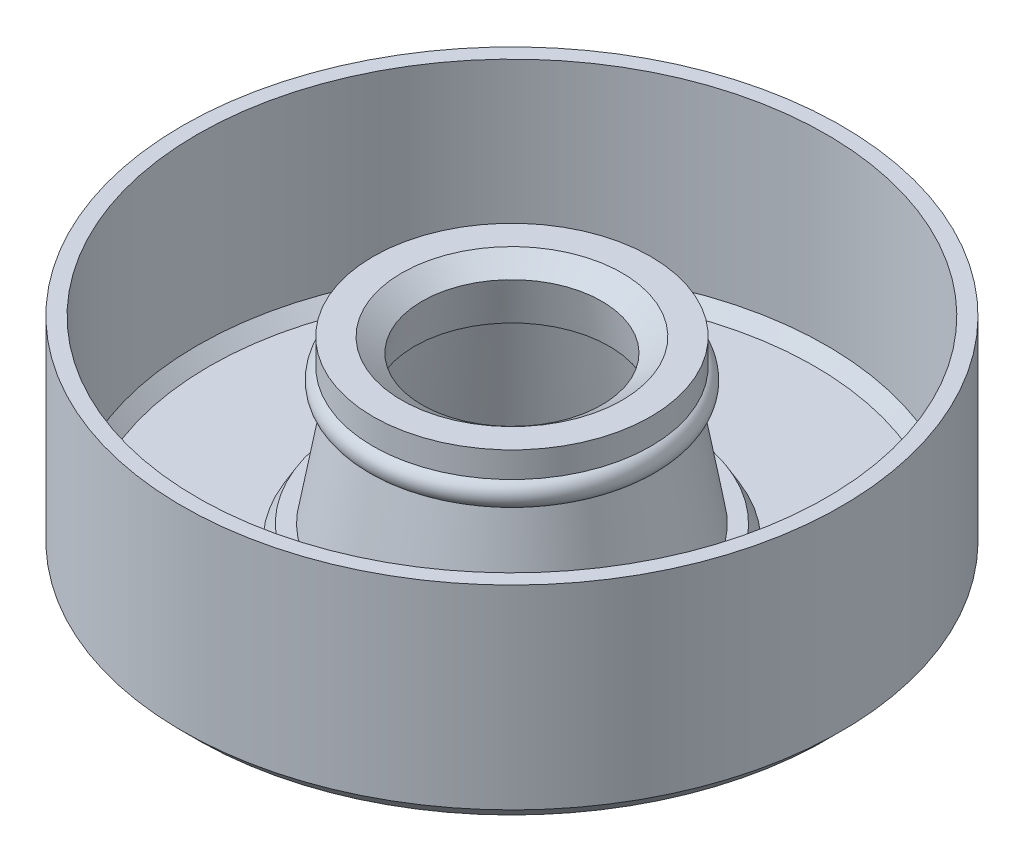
SolidWorks part; units mm, degrees
ref_plane "前视基准面" through (0, 0, 0) normal (0, 0, 1) x (1, 0, 0)
ref_plane "上视基准面" through (0, 0, 0) normal (0, 1, 0) x (1, 0, 0)
ref_plane "右视基准面" through (0, 0, 0) normal (1, 0, 0) x (0, 0, -1)
sketch "草图1" plane through (0, 0, 0) normal (0, 0, 1) x (1, 0, 0)
  line L0 (0, 5.8362) -> (0, -13.0481) construction
  line L1 (-10.1, 0.5) -> (-5.8736, 0.5)
  line L2 (-10.5, 0) -> (-4.7535, 0)
  line L3 (-5.0849, 1) -> (-5.5849, 1)
  line L4 (-11, 7) -> (-11, 0.5)
  line L5 (-10.5, 0.9) -> (-10.5, 7)
  line L6 (-11, 0.5) -> (-10.5, 0)
  line L7 (-10.5, 7) -> (-11, 7)
  line L8 (-10.5, 0.9) -> (-10.1, 0.5)
  line L9 (-3.2519, 4.5) -> (-3, 5.9286)
  line L10 (-3.2519, 4.5) -> (-3.9601, 4.5)
  line L11 (-4.7535, 0) -> (-3.9601, 4.5)
  line L12 (-4.4325, 4.7004) -> (-5.0849, 1)
  line L13 (-3.6801, 6.4048) -> (-4.6325, 6.4048)
  line L14 (-4.6325, 6.4048) -> (-4.6325, 5.5476)
  line L15 (-3, 5.9286) -> (-3.6801, 6.4048)
  line L16 (-5.5849, 1) -> (-5.8736, 0.5)
  line L17 (-10.5, 0) -> (-10.5, 0.5) construction
  line L18 (-5.5849, 1) -> (-5.5849, 0.5) construction
  line L19 (-4.9614, 1.7006) -> (-4.469, 1.6138) construction
  arc A0 (-4.6325, 5.5476) -> (-4.4325, 4.7004) centre (-4.4325, 5.1476) ccw
  dimension "D10" = 0.9524
  dimension "D11" = 0.4762
  dimension "b" = 7
  dimension "D2" = 135
  dimension "D3" = 120
  dimension "D4" = 100
  dimension "D7" = 0.4
  dimension "D8" = 145
  dimension "D9" = 0.2
  dimension "D12" = 0.8571
  dimension "D16" = 0.4
  dimension "D17" = 1.4286
  dimension "D18" = 4.5
  dimension "dm" = 22
  dimension "d1" = 6
  dimension "r" = 0.5
revolve "旋转1" add sketch "草图1" angle 360 about L0
equation "\"D18@草图1\" = \"b@草图1\" / 2 + 1"
equation "\"D17@草图1\" = ( \"b@草图1\" - \"D18@草图1\" )  / 7 * 4"
equation "\"D11@草图1\" = \"D17@草图1\" / 3"
equation "\"D10@草图1\" = \"D11@草图1\" * 2"
equation "\"D12@草图1\" = \"D10@草图1\" * 0.9"
equation "\"D7@草图1\" = \"r@草图1\" / 5 * 4"
equation "\"D9@草图1\" = \"D7@草图1\" / 2"
equation "\"D16@草图1\" = \"D7@草图1\""
